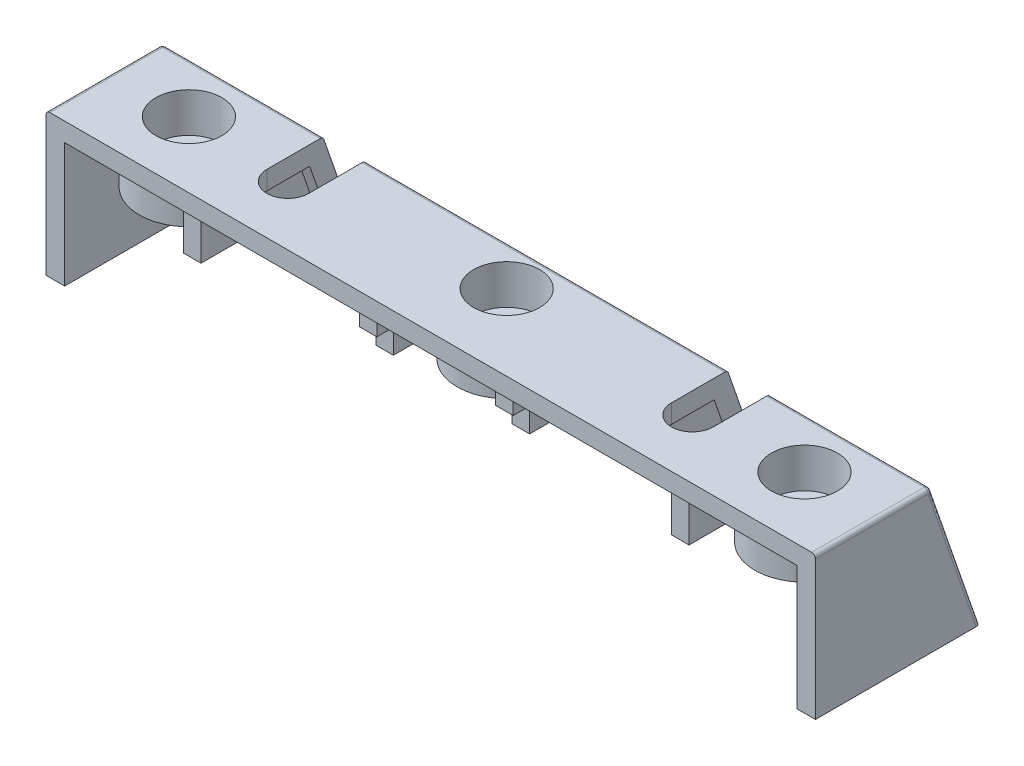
SolidWorks part; units mm, degrees
ref_plane "Face" through (0, 0, 0) normal (0, 0, 1) x (1, 0, 0)
ref_plane "Dessus" through (0, 0, 0) normal (0, 1, 0) x (1, 0, 0)
ref_plane "Droite" through (0, 0, 0) normal (1, 0, 0) x (0, 0, -1)
sketch "Esquisse1" plane through (0, 0, 0) normal (1, 0, 0) x (0, 0, -1)
  line L0 (10.5, 13) -> (15, 0)
  line L1 (0, 0) -> (15, 0)
  line L2 (0, 0) -> (0, 13)
  line L3 (0, 13) -> (10.5, 13)
  dimension "D1" = 15
  dimension "D2" = 13
  dimension "D3" = 10.5
extrude "Base-Extrusion" add sketch "Esquisse1" along normal mid plane 70
shell "Coque1" thickness 1.7
sketch "Esquisse2" plane through (0, 11.3, 0) normal (0, -1, 0) x (1, 0, 0)
  line L0 (0, 2.3584) -> (0, -17.2495) construction
  line L1 (33.3, 0) -> (-33.3, 0) construction
  circle A0 centre (0, -6.91) radius 4.5
  circle A1 centre (-28, -6) radius 4.5
  circle A2 centre (28, -6) radius 4.5
  dimension "D2" = 9
  dimension "D1" = 6
  dimension "D3" = 6.91
  dimension "D4" = 56
extrude "Boss.-Extru.1" add sketch "Esquisse2" along normal blind 3.8
sketch "Esquisse3" plane through (0, 7.5, 0) normal (0, -1, 0) x (1, 0, 0)
  circle A0 centre (-28, -6) radius 1.65
  circle A1 centre (0, -6.91) radius 1.65
  circle A2 centre (28, -6) radius 1.65
  circle A3 centre (-28, -6) radius 4.5 construction
  arc A4 (2.5686, -10.6049) -> (-2.5686, -10.6049) centre (0, -6.91) ccw construction
  circle A5 centre (28, -6) radius 4.5 construction
  dimension "D1" = 3.3
extrude "Enlèv. mat.-Extru.1" cut sketch "Esquisse3" against normal up to next
sketch "Esquisse4" plane through (0, 13, 0) normal (0, 1, 0) x (-1, 0, 0)
  circle A0 centre (28, -6) radius 3
  circle A1 centre (0, -6.91) radius 3
  circle A2 centre (-28, -6) radius 3
  circle A3 centre (28, -6) radius 1.65 construction
  circle A4 centre (0, -6.91) radius 1.65 construction
  circle A5 centre (-28, -6) radius 1.65 construction
  dimension "D1" = 6
extrude "Enlèv. mat.-Extru.2" cut sketch "Esquisse4" against normal blind 3.6
sketch "Esquisse5" plane through (0, 0, 0) normal (0, 0, 1) x (1, 0, 0)
  line L0 (0, 15.7286) -> (0, -9.8705) construction
  line L1 (-23, 11.3) -> (-21.4, 11.3)
  line L2 (-23, 11.3) -> (-23, 7.5)
  line L3 (-23, 7.5) -> (-21.4, 7.5)
  line L4 (-21.4, 11.3) -> (-21.4, 7.5)
  line L5 (-7, 11.3) -> (-5.4, 11.3)
  line L6 (-7, 11.3) -> (-7, 7.5)
  line L7 (-7, 7.5) -> (-5.4, 7.5)
  line L8 (-5.4, 11.3) -> (-5.4, 7.5)
  line L9 (5.4, 11.3) -> (7, 11.3)
  line L10 (5.4, 11.3) -> (5.4, 7.5)
  line L11 (5.4, 7.5) -> (7, 7.5)
  line L12 (7, 11.3) -> (7, 7.5)
  line L13 (21.4, 11.3) -> (23, 11.3)
  line L14 (21.4, 11.3) -> (21.4, 7.5)
  line L15 (21.4, 7.5) -> (23, 7.5)
  line L16 (23, 11.3) -> (23, 7.5)
  line L17 (0, 9.4) -> (0, 7.5) construction
  line L18 (33.3, 11.3) -> (-33.3, 11.3) construction
  line L19 (-4.5, 7.5) -> (4.5, 7.5) construction
  dimension "D1" = 10.8
  dimension "D2" = 1.6
  dimension "D3" = 42.8
extrude "Boss.-Extru.2" add sketch "Esquisse5" against normal up to surface (9.2895 mm away)
sketch "Esquisse6" plane through (0, 0, 0) normal (0, 0, 1) x (1, 0, 0)
  line L0 (-21.4, 7.5) -> (-21.4, 11.3) construction
  line L1 (-23, 7.5) -> (-21.4, 7.5) construction
  line L2 (-23, 11.3) -> (-23, 7.5) construction
  line L3 (-21.4, 7.5) -> (-21.4, 11.3)
  line L4 (-23, 7.5) -> (-21.4, 7.5)
  line L5 (-23, 11.3) -> (-23, 7.5)
  line L6 (-7, 11.3) -> (-21.4, 11.3) construction
  line L7 (23, 11.3) -> (21.4, 11.3)
  line L8 (-5.4, 7.5) -> (-5.4, 11.3) construction
  line L9 (-7, 7.5) -> (-5.4, 7.5) construction
  line L10 (-7, 11.3) -> (-7, 7.5) construction
  line L11 (-5.4, 7.5) -> (-5.4, 11.3)
  line L12 (-7, 7.5) -> (-5.4, 7.5)
  line L13 (-7, 11.3) -> (-7, 7.5)
  line L14 (7, 7.5) -> (7, 11.3) construction
  line L15 (5.4, 7.5) -> (7, 7.5) construction
  line L16 (5.4, 11.3) -> (5.4, 7.5) construction
  line L17 (7, 7.5) -> (7, 11.3)
  line L18 (5.4, 7.5) -> (7, 7.5)
  line L19 (5.4, 11.3) -> (5.4, 7.5)
  line L20 (23, 7.5) -> (23, 11.3) construction
  line L21 (21.4, 7.5) -> (23, 7.5) construction
  line L22 (21.4, 11.3) -> (21.4, 7.5) construction
  line L23 (23, 7.5) -> (23, 11.3)
  line L24 (21.4, 7.5) -> (23, 7.5)
  line L25 (21.4, 11.3) -> (21.4, 7.5)
  line L26 (7, 11.3) -> (5.4, 11.3)
  line L27 (-5.4, 11.3) -> (-7, 11.3)
  line L28 (-21.4, 11.3) -> (-23, 11.3)
extrude "Enlèv. mat.-Extru.3" cut sketch "Esquisse6" against normal blind 0.5
sketch "Esquisse7" plane through (0, 0, -0.5) normal (0, 0, 1) x (1, 0, 0)
  line L0 (5.4, 7.5) -> (7, 7.5) construction
  line L1 (5.4, 11.3) -> (5.4, 7.5) construction
  line L2 (-5.4, 7.5) -> (-5.4, 11.3) construction
  line L3 (-7, 7.5) -> (-5.4, 7.5) construction
  line L4 (-7, 11.3) -> (-7, 7.5) construction
  line L5 (5.4, 7.5) -> (7, 7.5)
  line L6 (5.4, 9.7) -> (5.4, 7.5)
  line L7 (-5.4, 7.5) -> (-5.4, 9.7)
  line L8 (-7, 7.5) -> (-5.4, 7.5)
  line L9 (-7, 9.7) -> (-7, 7.5)
  line L10 (7, 7.5) -> (7, 11.3) construction
  line L11 (7, 7.5) -> (7, 9.7)
  line L12 (-7, 9.7) -> (-5.4, 9.7)
  line L13 (5.4, 9.7) -> (7, 9.7)
  line L15 (33.3, 11.3) -> (-33.3, 11.3) construction
  dimension "D1" = 1.6
extrude "Enlèv. mat.-Extru.4" cut sketch "Esquisse7" against normal blind 1.5
ref_plane "Plan1" through (18.4, 0, 0) normal (1, 0, 0) x (0, 0, -1)
sketch "Esquisse8" plane through (18.4, 0, 0) normal (1, 0, 0) x (0, 0, -1)
  line L0 (10.5, 13) -> (0, 13) construction
  line L1 (10.5, 13) -> (3.5, 13)
  line L2 (15, 0) -> (10.5, 13) construction
  line L3 (12.6462, 6.8) -> (10.5, 13)
  line L4 (3.5, 13) -> (3.5, 6.8)
  line L5 (3.5, 6.8) -> (12.6462, 6.8)
  line L6 (0, 13) -> (0, 0) construction
  line L7 (0, 0) -> (15, 0) construction
  dimension "D1" = 3.5
  dimension "D2" = 6.8
extrude "Enlèv. mat.-Extru.5" cut sketch "Esquisse8" against normal mid plane 3.8
mirror "Symétrie1" about plane through (0, 0, 0) normal (1, 0, 0) of "Enlèv. mat.-Extru.5"
fillet "Congé1" radius 1.9 16 edges at (18.4, 6.8, -10.8472) (18.4, 11.3, -3.5) (16.5, 6.8, -11.7467) (18.4, 6.8, -12.6462) (16.5, 12.15, -3.5) (18.4, 13, -3.5) (20.3, 6.8, -11.7467) (20.3, 12.15, -3.5) (-18.4, 6.8, -12.6462) (-20.3, 12.15, -3.5) (-18.4, 11.3, -3.5) (-18.4, 13, -3.5) (-18.4, 6.8, -10.8472) (-20.3, 6.8, -11.7467) (-16.5, 6.8, -11.7467) (-16.5, 12.15, -3.5)
sketch "Esquisse9" plane through (0, 0, 0) normal (1, 0, 0) x (0, 0, -1)
  line L0 (15, 0) -> (10.5, 13) construction
  line L1 (11.41, 10.3711) -> (11.0885, 11.3)
  line L2 (11.41, 11.3) -> (11.0885, 11.3) construction
  line L3 (11.41, 11.3) -> (11.0885, 11.3)
  line L4 (11.41, 10.3711) -> (11.41, 11.3) construction
  line L5 (11.41, 10.3711) -> (11.41, 11.3)
extrude "Enlèv. mat.-Extru.6" cut sketch "Esquisse9" against normal through all and the other way through all
fillet "Congé2" radius 0.35 7 edges at (35, 6.5, -12.75) (35, 13, -5.25) (0, 13, -10.5) (-27.65, 13, -10.5) (-35, 13, -5.25) (-35, 6.5, -12.75) (27.65, 13, -10.5)
